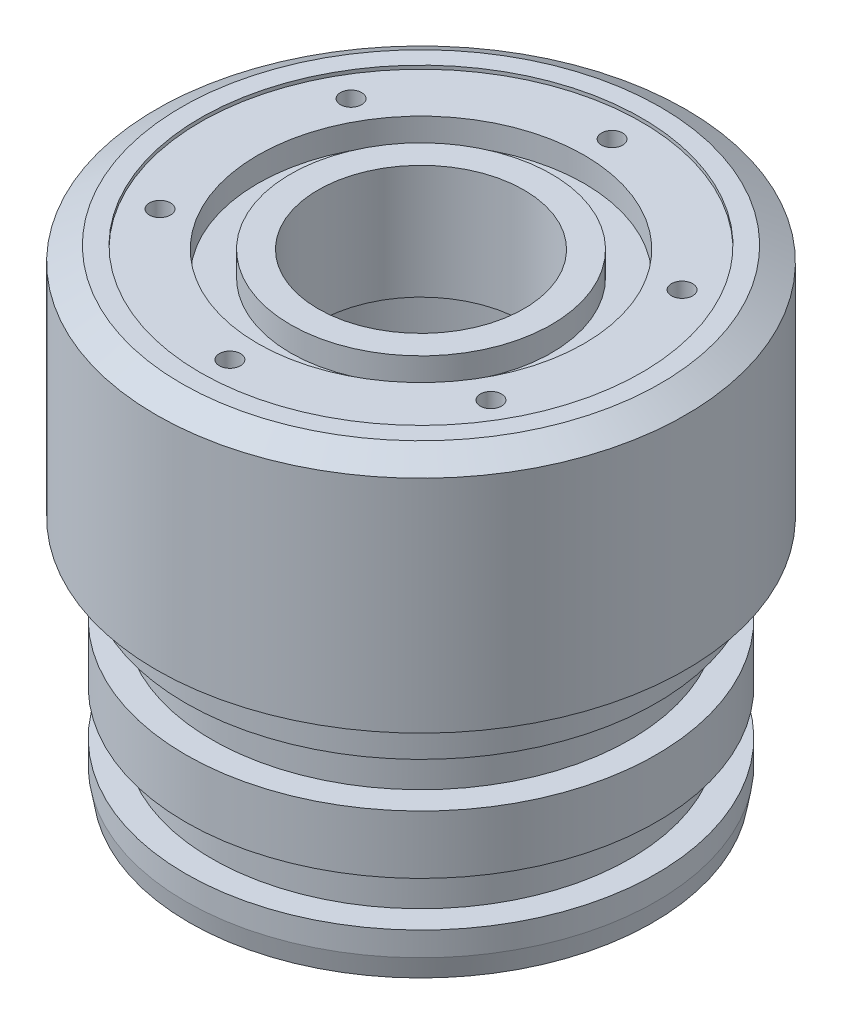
SolidWorks part; units mm, degrees
ref_plane "Front Plane" through (0, 0, 0) normal (0, 0, 1) x (1, 0, 0)
ref_plane "Top Plane" through (0, 0, 0) normal (0, 1, 0) x (1, 0, 0)
ref_plane "Right Plane" through (0, 0, 0) normal (1, 0, 0) x (0, 0, -1)
sketch "Sketch1" plane through (0, 0, 0) normal (0, 1, 0) x (1, 0, 0)
  circle A0 centre (0, 0) radius 25.4
  dimension "D1" = 50.8
extrude "Boss-Extrude1" add sketch "Sketch1" against normal blind 25.4
sketch "Sketch2" plane through (0, 0, 0) normal (0, 1, 0) x (1, 0, 0)
  circle A0 centre (0, 0) radius 28.575
  dimension "D1" = 57.15
extrude "Boss-Extrude2" add sketch "Sketch2" along normal blind 25.4
sketch "Sketch6" plane through (0, -25.4, 0) normal (0, -1, 0) x (1, 0, 0)
  circle A0 centre (0, 0) radius 19.05
  dimension "D1" = 38.1
extrude "Cut-Extrude3" cut sketch "Sketch6" against normal blind 38.1
sketch "Sketch7" plane through (0, -25.4, 0) normal (0, -1, 0) x (1, 0, 0)
  circle A0 centre (0, 0) radius 22.5806
  dimension "D1" = 45.1612
extrude "Cut-Extrude4" cut sketch "Sketch7" against normal blind 4.826 from offset 4.7498 flip side to cut
sketch "Sketch8" plane through (0, -25.4, 0) normal (0, -1, 0) x (1, 0, 0)
  circle A0 centre (0, 0) radius 22.5806
  dimension "D1" = 45.1612
extrude "Cut-Extrude6" cut sketch "Sketch8" against normal blind 4.826 from offset 15.875 flip side to cut
chamfer "Chamfer1" distance 0.381 angle 80 1 edges at (0, -25.4, 25.4)
chamfer "Chamfer2" distance 1.5748 angle 60 1 edges at (0, 25.4, 28.575)
sketch "Sketch9" plane through (0, 25.4, 0) normal (0, 1, 0) x (1, 0, 0)
  circle A0 centre (0, 0) radius 11.1125
  dimension "D1" = 22.225
extrude "Cut-Extrude7" cut sketch "Sketch9" against normal through all
sketch "Sketch10" plane through (0, 25.4, 0) normal (0, 1, 0) x (1, 0, 0)
  circle A0 centre (0, 0) radius 23.8125
  dimension "D1" = 47.625
extrude "Cut-Extrude8" cut sketch "Sketch10" against normal blind 0.381
sketch "Sketch11" plane through (0, 25.019, 0) normal (0, 1, 0) x (1, 0, 0)
  circle A0 centre (0, 0) radius 14.0843
  circle A1 centre (0, 0) radius 17.6149
  dimension "D1" = 28.1686
  dimension "D2" = 35.2298
extrude "Cut-Extrude9" cut sketch "Sketch11" against normal blind 2.6416
sketch "Sketch12" plane through (0, 25.019, 0) normal (0, 1, 0) x (1, 0, 0)
  circle A0 centre (0, 20.6248) radius 1.143
  dimension "D1" = 2.286
  dimension "D2" = 20.6248
extrude "Cut-Extrude10" cut sketch "Sketch12" against normal blind 7.9248
pattern_circular "CirPattern1" count 6 over 360 about axis through (0, 0, 0) along (0, 1, 0) of "Cut-Extrude10"
